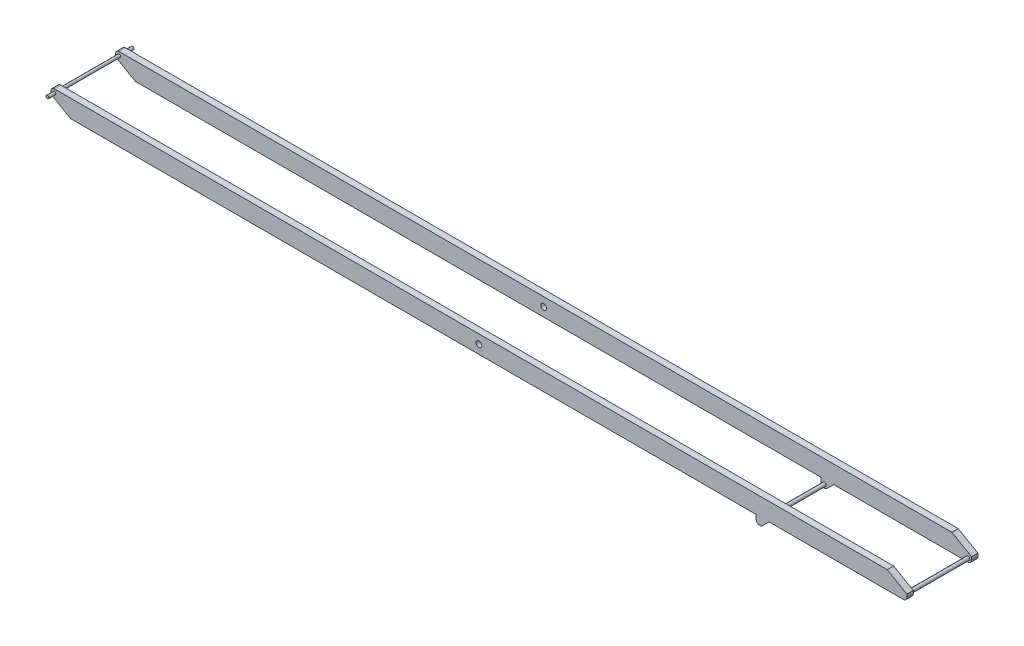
SolidWorks part; units mm, degrees
ref_plane "Face" through (0, 0, 0) normal (0, 0, 1) x (1, 0, 0)
ref_plane "Dessus" through (0, 0, 0) normal (0, 1, 0) x (1, 0, 0)
ref_plane "Droite" through (0, 0, 0) normal (1, 0, 0) x (0, 0, -1)
sketch "Esquisse1" plane through (0, 0, 0) normal (0, 0, 1) x (1, 0, 0)
  line L0 (50, 0) -> (50, 40)
  line L1 (-227.1281, 200) -> (-11950, 200)
  line L2 (-12000, 110) -> (-11722.8719, -50)
  line L3 (0, -50) -> (-11722.8719, -50)
  line L4 (-12000, 150) -> (-12000, 110)
  line L5 (50, 40) -> (-227.1281, 200)
  circle A0 centre (0, 0) radius 25
  arc A1 (0, -50) -> (50, 0) centre (0, 0) ccw
  circle A2 centre (-11949.0585, 150) radius 20
  arc A3 (-11950, 200) -> (-12000, 150) centre (-11950, 150) ccw
  dimension "D1" = 50
  dimension "D2" = 200
  dimension "D4" = 40
  dimension "D8" = 50
  dimension "D3" = 12000
  dimension "D5" = 11950
  dimension "D6" = 250
  dimension "D7" = 50
  dimension "D9" = 30
  dimension "D10" = 40
  dimension "D11" = 30
  dimension "D12" = 40
extrude "Extrusion1" add sketch "Esquisse1" along normal mid plane 1000
sketch "Esquisse2" plane through (0, 200, 0) normal (0, 1, 0) x (1, 0, 0)
  line L0 (-227.1281, 500) -> (-11950, 500) construction
  line L1 (-13013.7618, 410) -> (211.9968, 410)
  line L2 (-13013.7618, 410) -> (-13013.7618, -410)
  line L3 (-13013.7618, -410) -> (211.9968, -410)
  line L4 (211.9968, 410) -> (211.9968, -410)
  dimension "D1" = 820
  dimension "D2" = 90
extrude "Enlèv. mat.-Extru.1" cut sketch "Esquisse2" against normal through all
sketch "Esquisse3" plane through (0, 0, 0) normal (0, 0, 1) x (1, 0, 0)
  circle A0 centre (-11949.0585, 150) radius 20
  circle A1 centre (-11949.0585, 150) radius 20 construction
extrude "Extrusion2" add sketch "Esquisse3" along normal mid plane 1200
sketch "Esquisse4" plane through (0, 0, 0) normal (0, 0, 1) x (1, 0, 0)
  circle A0 centre (0, 0) radius 25 construction
  circle A1 centre (0, 0) radius 25
extrude "Extrusion3" add sketch "Esquisse4" along normal mid plane 1000
sketch "Esquisse5" plane through (0, 0, 0) normal (0, 0, 1) x (1, 0, 0)
  line L1 (-227.1281, 200) -> (-11950, 200) construction
  circle A0 centre (-5974.5293, 75) radius 40
  dimension "D1" = 80
  dimension "D2" = 5975
  dimension "D3" = 125
sketch "Esquisse7" plane through (0, 0, 0) normal (0, 0, 1) x (1, 0, 0)
  line L0 (-11722.8719, -50) -> (0, -50) construction
  circle A0 centre (-2022.0101, -110) radius 25
  dimension "D3" = 50
  dimension "D1" = 2025
  dimension "D2" = 60
extrude "Extrusion4" add sketch "Esquisse7" along normal mid plane 1000
sketch "Esquisse8" plane through (0, 0, 500) normal (0, 0, 1) x (1, 0, 0)
  line L0 (-2072.0101, -110) -> (-2072.0101, -36.3839)
  line L1 (-2072.0101, -36.3839) -> (-1876.8759, -36.3839)
  line L2 (-1876.8759, -36.3839) -> (-1986.7855, -145.4855)
  arc A0 (-2072.0101, -110) -> (-1986.7855, -145.4855) centre (-2022.0101, -110) ccw
  dimension "D1" = 100
extrude "Extrusion5" add sketch "Esquisse8" against normal up to surface (90 mm away)
sketch "Esquisse9" plane through (0, 0, -500) normal (0, 0, -1) x (-1, 0, 0)
  line L8 (11722.8719, -50) -> (12000, 110)
  line L9 (0, -50) -> (1890.5929, -50)
  line L10 (1890.5929, -50) -> (1986.7855, -145.4855)
  line L11 (2072.0101, -110) -> (2072.0101, -50)
  line L12 (2072.0101, -50) -> (11722.8719, -50)
  line L13 (11722.8719, -50) -> (12000, 110)
  line L15 (11950, 200) -> (227.1281, 200)
  line L16 (227.1281, 200) -> (-50, 40)
  line L17 (-50, 40) -> (-50, 0)
  line L18 (0, -50) -> (1890.5929, -50)
  line L19 (1890.5929, -50) -> (1986.7855, -145.4855)
  line L20 (2072.0101, -110) -> (2072.0101, -50)
  line L21 (2072.0101, -50) -> (11722.8719, -50)
  line L22 (12000, 110) -> (12000, 150)
  line L23 (12000, 110) -> (12000, 150)
  line L24 (11950, 200) -> (227.1281, 200)
  line L25 (227.1281, 200) -> (-50, 40)
  line L26 (-50, 40) -> (-50, 0)
  arc A3 (1986.7855, -145.4855) -> (2072.0101, -110) centre (2022.0101, -110) ccw
  arc A4 (12000, 150) -> (11950, 200) centre (11950, 150) ccw
  arc A5 (-50, 0) -> (0, -50) centre (0, 0) ccw
  arc A6 (1986.7855, -145.4855) -> (2072.0101, -110) centre (2022.0101, -110) ccw
  arc A7 (12000, 150) -> (11950, 200) centre (11950, 150) ccw
  arc A8 (-50, 0) -> (0, -50) centre (0, 0) ccw
  dimension "D1" = 0
extrude "Extrusion6" add sketch "Esquisse9" against normal up to surface (90 mm away)
extrude "Enlèv. mat.-Extru.3" cut sketch "Esquisse5" against normal through all and the other way through all
